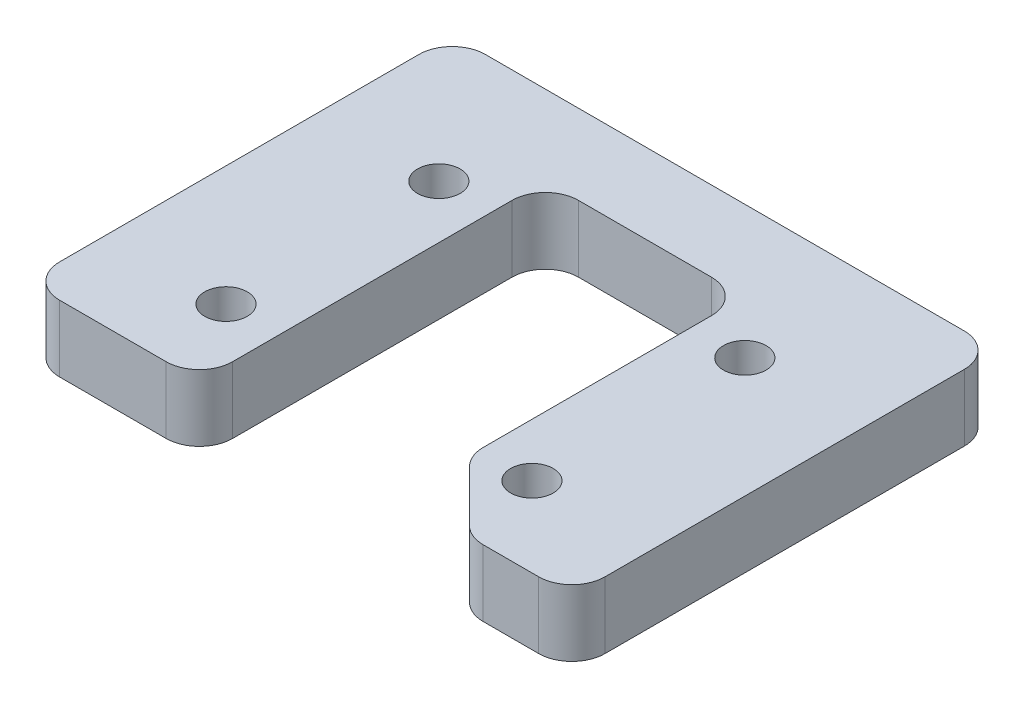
SolidWorks part; units mm, degrees
ref_plane "Plan de face" through (0, 0, 0) normal (0, 0, 1) x (1, 0, 0)
ref_plane "Plan de dessus" through (0, 0, 0) normal (0, 1, 0) x (1, 0, 0)
ref_plane "Plan de droite" through (0, 0, 0) normal (1, 0, 0) x (0, 0, -1)
sketch "Esquisse1" plane through (0, 0, 0) normal (0, 1, 0) x (1, 0, 0)
  line L1 (-41, 32) -> (41, 32)
  line L2 (-41, 32) -> (-41, -32)
  line L3 (-41, -32) -> (41, -32)
  line L4 (41, 32) -> (41, -32)
  line L5 (-41, 32) -> (41, -32) construction
  line L6 (-41, -32) -> (41, 32) construction
  point P0 (0, 0)
  dimension "D1" = 82
  dimension "D2" = 64
extrude "brut rectangle" add sketch "Esquisse1" along normal blind 10
sketch "Esquisse2" plane through (0, 10, 0) normal (0, 1, 0) x (-1, 0, 0)
  line L0 (0, -55.31) -> (0, 55.1642) construction
  line L1 (-41, -32) -> (41, -32) construction
  line L2 (41, 32) -> (-41, 32) construction
  line L3 (-15, -20) -> (-15, 21.3934)
  line L4 (-15, -20) -> (15, -20)
  line L5 (15, -20) -> (15, 32)
  line L7 (-15, 21.3934) -> (-25.6066, 32)
  line L11 (-25.6066, 32) -> (15, 32)
  dimension "D3" = 12
  dimension "D1" = 45
  dimension "D4" = 30
  dimension "D2" = 15
extrude "Evidement" cut sketch "Esquisse2" against normal blind 10
sketch "Esquisse3" plane through (0, 10, 0) normal (0, 1, 0) x (-1, 0, 0)
  line L0 (23, -12) -> (23, 20) construction
  line L1 (23, 20) -> (-23, 20) construction
  line L2 (-23, 20) -> (-23, -12) construction
  line L3 (-23, -12) -> (23, -12) construction
  line L4 (0, -54.2047) -> (0, 53.3405) construction
  line L5 (-48.9068, 0) -> (55.2512, 0) construction
  line L6 (-41, -32) -> (41, -32) construction
  circle A0 centre (23, -12) radius 3.2
  circle A1 centre (23, 20) radius 3.2
  circle A2 centre (-23, 20) radius 3.2
  circle A3 centre (-23, -12) radius 3.2
  dimension "D1" = 6.4
  dimension "D2" = 20
  dimension "D3" = 46
  dimension "D4" = 32
extrude "Passages vis" cut sketch "Esquisse3" against normal blind 10
fillet "Congé1" radius 5 9 edges at (41, 5, -32) (-41, 5, -32) (-41, 5, 32) (-15, 5, 32) (41, 5, 32) (-15, 5, -20) (15, 5, -20) (15, 5, 21.3934) (25.6066, 5, 32)
